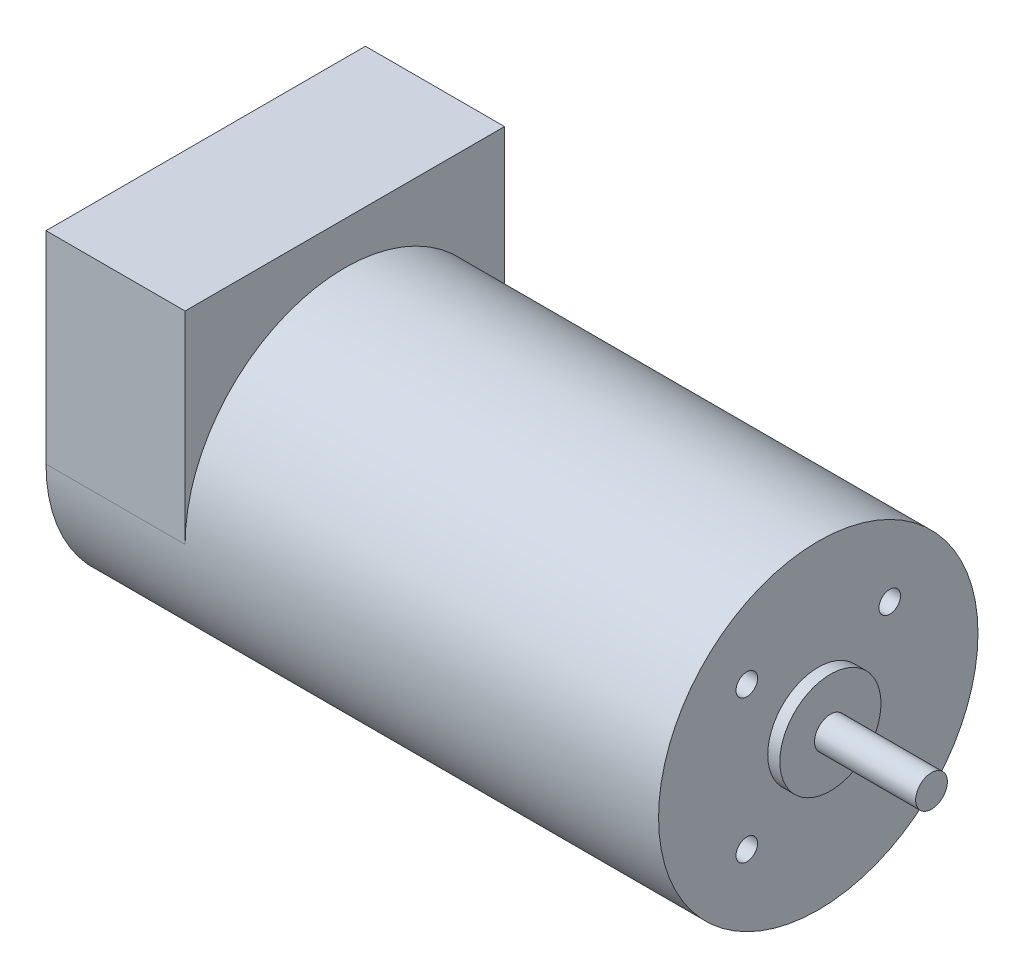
SolidWorks part; units mm, degrees
ref_plane "Front Plane" through (0, 0, 0) normal (0, 0, 1) x (1, 0, 0)
ref_plane "Top Plane" through (0, 0, 0) normal (0, 1, 0) x (1, 0, 0)
ref_plane "Right Plane" through (0, 0, 0) normal (1, 0, 0) x (0, 0, -1)
sketch "Sketch1" plane through (0, 0, 0) normal (1, 0, 0) x (0, 0, -1)
  line L0 (20.066, 0) -> (20.066, 25.4)
  line L1 (20.066, 25.4) -> (-20.066, 25.4)
  line L2 (-20.066, 25.4) -> (-20.066, 0)
  arc A0 (20.066, 0) -> (-20.066, 0) centre (0, 0) cw
  dimension "D1" = 20.066
  dimension "D2" = 25.4
extrude "Boss-Extrude1" add sketch "Sketch1" along normal blind 17.4752
sketch "Sketch2" plane through (17.4752, 0, 0) normal (1, 0, 0) x (0, 0, -1)
  circle A0 centre (0, 0) radius 20.066
  dimension "D1" = 40.132
extrude "Boss-Extrude2" add sketch "Sketch2" along normal blind 59.4868
sketch "Sketch3" plane through (76.962, 0, 0) normal (1, 0, 0) x (0, 0, -1)
  circle A0 centre (0, 0) radius 6.35
  dimension "D1" = 12.7
extrude "Boss-Extrude3" add sketch "Sketch3" along normal blind 1.524
sketch "Sketch4" plane through (78.486, 0, 0) normal (1, 0, 0) x (0, 0, -1)
  circle A0 centre (0, 0) radius 1.9939
  dimension "D1" = 3.9878
extrude "Boss-Extrude4" add sketch "Sketch4" along normal blind 12.7
hole_wizard "#6-32 Tapped Hole1" positions "Sketch6" profile "Sketch5" tap size "#6-32" standard "ANSI Inch"
sketch "Sketch6" plane through (76.962, 0, 0) normal (1, 0, 0) x (0, 0, -1)
  line L0 (0, 0) -> (-8.9803, 8.9803) construction
  line L2 (0, 0) -> (-10.8742, 0) construction
  point P0 (-8.9803, 8.9803)
  dimension "D1" = 12.7
  dimension "D2" = 45
sketch "Sketch5" plane through (76.962, 8.9803, 8.9803) normal (0, 1, 0) x (0, 0, -1)
  line L0 (0, 0) -> (0, 10.2107)
  line L1 (0, 10.2107) -> (1.3525, 9.398)
  line L2 (1.3525, 9.398) -> (1.3525, 0)
  line L5 (1.3525, 0) -> (0, 0)
  line L10 (0, 10.2107) -> (-1.3526, 9.398) construction
  line L11 (0, -6.35) -> (0, 107.95) construction
  dimension "Tap Drill Dia." = 2.7051
  dimension "Tap Drill Depth" = 9.398
  dimension "Drill Angle" = 118
pattern_circular "CirPattern1" count 4 over 360 about axis through (0, 0, 0) along (1, 0, 0) of "#6-32 Tapped Hole1"
